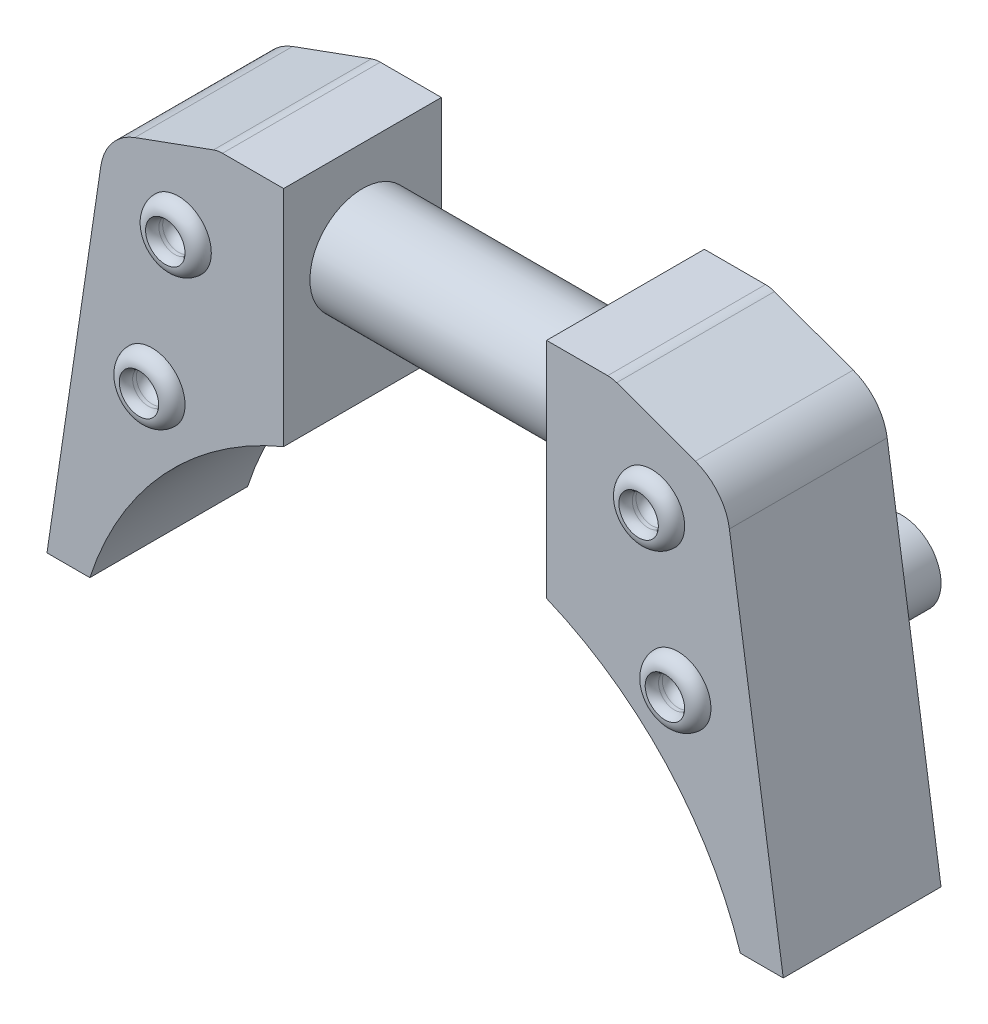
SolidWorks part; units mm, degrees
ref_plane "Plan1" through (0, 0, 0) normal (0, 0, 1) x (1, 0, 0)
ref_plane "Plan2" through (0, 0, 0) normal (0, 1, 0) x (1, 0, 0)
ref_plane "Plan3" through (0, 0, 0) normal (1, 0, 0) x (0, 0, -1)
sketch "Esquisse1" plane through (0, 0, 0) normal (0, 0, 1) x (1, 0, 0)
  line L0 (-5, 20.5) -> (-5, 12)
  line L1 (-7.5, 20.5) -> (-5, 20.5)
  line L5 (-7.5, 20.5) -> (-11.7769, 18.9433)
  line L6 (-14, 4) -> (-12.3693, 4)
  line L7 (-14, 4) -> (-11.7769, 18.9433)
  arc A0 (-5, 12) -> (-12.3693, 4) centre (0, 0) ccw
  dimension "D1" = 26
  dimension "D2" = 20.5
  dimension "D3" = 14
  dimension "D4" = 5
  dimension "D6" = 20
  dimension "D7" = 4
extrude "Base-Extrusion" add sketch "Esquisse1" along normal blind 6
sketch "Esquisse2" plane through (0, 0, 0) normal (0, 0, -1) x (-1, 0, 0)
  line L0 (5, 12) -> (5, 20.5) construction
  line L1 (5, 20.5) -> (7.5, 20.5) construction
  circle A0 centre (10, 11.5) radius 1.5
  dimension "D1" = 5
  dimension "D2" = 9
  dimension "D3" = 3
extrude "Boss.-Extru.1" add sketch "Esquisse2" along normal blind 2.5
sketch "Esquisse3" plane through (0, 0, 0) normal (0, 0, -1) x (-1, 0, 0)
  line L0 (5, 12) -> (5, 20.5) construction
  circle A0 centre (9, 17) radius 1.5
  circle A1 centre (10, 11.5) radius 1.5 construction
  dimension "D1" = 5.5
  dimension "D2" = 3
  dimension "D3" = 4
extrude "Boss.-Extru.2" add sketch "Esquisse3" along normal blind 1
sketch "Esquisse4" plane through (0, 0, 6) normal (0, 0, 1) x (1, 0, 0)
  circle A0 centre (-10, 11.5) radius 1.25
  circle A1 centre (-9, 17) radius 1.25
  dimension "D1" = 2.5
  dimension "D2" = 2.5
extrude "Boss.-Extru.3" add sketch "Esquisse4" along normal blind 0.5
sketch "Esquisse5" plane through (0, 0, 6.5) normal (0, 0, 1) x (1, 0, 0)
  circle A0 centre (-9, 17) radius 0.6
  circle A1 centre (-10, 11.5) radius 0.6
  dimension "D1" = 1.2
  dimension "D2" = 1.2
extrude "Enlèv. mat.-Extru.1" cut sketch "Esquisse5" against normal blind 1
fillet "Congé2" radius 0.5
fillet "Congé3" radius 0.5
sketch "Esquisse6" plane through (-5, 0, 0) normal (1, 0, 0) x (0, 0, -1)
  line L0 (-6, 12) -> (-6, 20.5) construction
  line L1 (-6, 12) -> (0, 12) construction
  circle A0 centre (-3, 17) radius 2
  dimension "D1" = 4
  dimension "D2" = 3
  dimension "D3" = 5
extrude "Boss.-Extru.4" add sketch "Esquisse6" along normal blind 12
mirror "Symétrie5" about plane through (0, 0, 0) normal (1, 0, 0)
fillet "Congé4" radius 2
fillet "Congé5" radius 1
